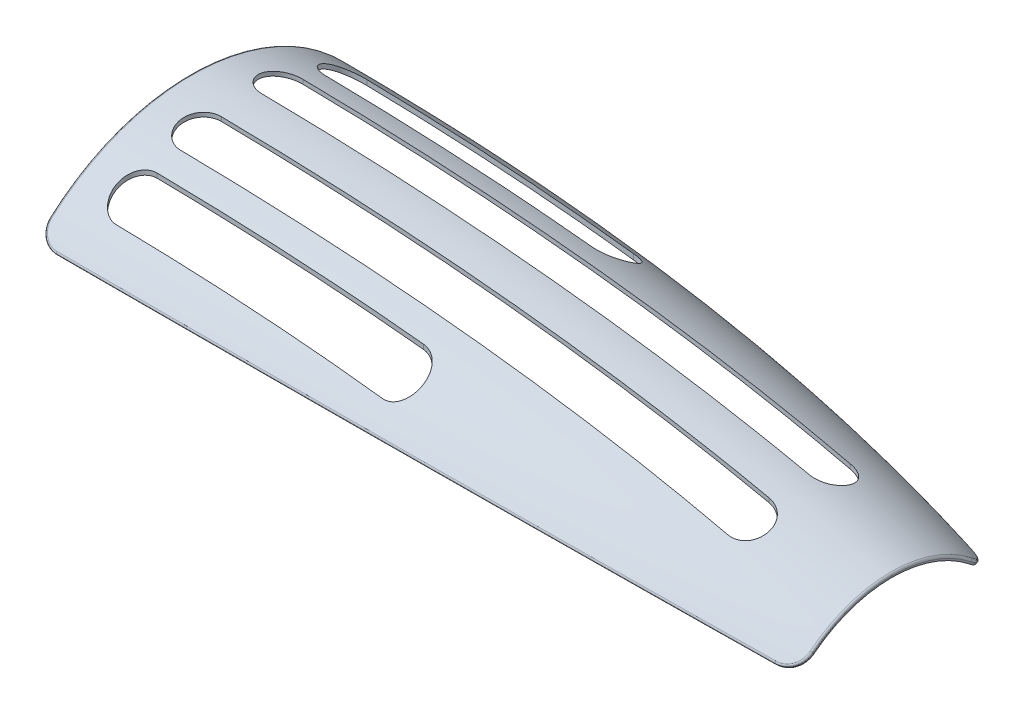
SolidWorks part; units mm, degrees
ref_plane "Plan de face" through (0, 0, 0) normal (0, 0, 1) x (1, 0, 0)
ref_plane "Plan de dessus" through (0, 0, 0) normal (0, 1, 0) x (1, 0, 0)
ref_plane "Plan de droite" through (0, 0, 0) normal (1, 0, 0) x (0, 0, -1)
sketch "Esquisse1" plane through (0, 0, 0) normal (0, 0, 1) x (1, 0, 0)
  line L0 (1937.5186, 118.6008) -> (1937.5186, 33.3089) construction
  line L1 (942.5017, 0) -> (1327.7299, 0) construction
  line L2 (1438.1567, 0) -> (2177.3993, 0) construction
  line L3 (2047, 0) -> (1597, 0) construction
  line L4 (1937.5186, 60.5987) -> (1938.0448, 62.5283)
  line L5 (1597, 102) -> (1597, 100)
  spline S0 degree 3 poles (609.8277, -59.5928) (1435.3906, 164.1167) (2212.55, 34.6313) (2075.8351, -47.2571) (1184.8244, -506.5688) knots -0.725956 -0.725956 -0.725956 -0.725956 0.598241 2.066098 2.066098 2.066098 2.066098 only from (1597, 100) to (2047, 0) construction
  spline S1 degree 3 poles (1597, 100) (1755.2575, 100) (1863.5764, 80.7626) (1937.5186, 60.5987) knots 0 0 0 0 0.523813 0.523813 0.523813 0.523813
  spline S2 degree 1 poles (1597, 102) (1938.0448, 62.5283) knots 0 0 1 1 construction
  spline S3 degree 3 poles (1597, 102) (1599.4631, 102) (1604.407, 101.9906) (1614.1538, 101.9347) (1626.1714, 101.7965) (1640.2993, 101.5244) (1658.7601, 101.0247) (1681.1327, 100.1514) (1706.8786, 98.7325) (1731.5456, 96.9694) (1763.0269, 94.1956) (1799.7952, 90.0019) (1833.2706, 85.0185) (1858.166, 80.6653) (1875.9177, 77.244) (1892.7722, 73.6931) (1906.0891, 70.6485) (1916.3162, 68.1749) (1923.7774, 66.3039) (1929.8189, 64.7355) (1934.5576, 63.4742) (1936.879, 62.8462) (1938.0448, 62.5283) knots 0 0 0 0 0.008185 0.016369 0.032738 0.049107 0.065477 0.098215 0.130953 0.163692 0.19643 0.261907 0.327383 0.360122 0.39286 0.425598 0.458337 0.474706 0.491075 0.507444 0.515629 0.523813 0.523813 0.523813 0.523813
  dimension "D1" = 2
revolve "Révolution1" add sketch "Esquisse1" angle 95 about L1
fillet "Congé1" radius 10 4 edges at (1937.7817, 41.5917, 45.3894) (1937.7817, 41.5917, -45.3894) (1597, 68.2346, -74.465) (1597, 68.2346, 74.465)
fillet "Congé2" radius 1 8 edges at (1934.6039, 44.461, 45.2801) (1938.0448, 62.5283, 0) (1935.8784, 45.1392, -44.1146) (1600.754, 70.5069, -73.7023) (1597, 102, 0) (1599.1806, 71.6393, 72.6055)
sketch "Esquisse2" plane through (0, 0, 0) normal (0, 1, 0) x (1, 0, 0)
  line L0 (1550.6258, 0) -> (1980.5646, 0) construction
  line L1 (1842.4826, 0) -> (1616.8127, 0) construction
  line L2 (1622, 19.7401) -> (1887.6186, 19.7401) construction
  line L3 (1622, 29.7401) -> (1887.6186, 29.7401)
  line L4 (1622, 9.7401) -> (1887.6186, 9.7401)
  line L5 (1622, 50.887) -> (1751.2851, 50.887) construction
  line L6 (1622, 60.887) -> (1751.2851, 60.887)
  line L7 (1622, 40.887) -> (1751.2851, 40.887)
  line L8 (1597, 67.343) -> (1597, -67.343) construction
  arc A0 (1622, 29.7401) -> (1622, 9.7401) centre (1622, 19.7401) ccw
  arc A1 (1887.6186, 9.7401) -> (1887.6186, 29.7401) centre (1887.6186, 19.7401) ccw
  arc A2 (1622, 60.887) -> (1622, 40.887) centre (1622, 50.887) ccw
  arc A3 (1751.2851, 40.887) -> (1751.2851, 60.887) centre (1751.2851, 50.887) ccw
  point P7 (1754.8093, 19.7401)
  point P12 (1686.6425, 50.887)
  dimension "D1" = 10
  dimension "D2" = 10
  dimension "D3" = 25
extrude "Enlèv. mat.-Extru.2" cut sketch "Esquisse2" along normal through all
mirror "Symétrie1" about plane through (0, 0, 0) normal (0, 0, 1) of "Enlèv. mat.-Extru.2"
sketch "Esquisse3" plane through (0, 0, 0) normal (0, 0, 1) x (1, 0, 0)
  line L1 (1558.4783, 142.7147) -> (1958.4404, 142.7147)
  line L2 (1558.4783, 142.7147) -> (1558.4783, 12.206)
  line L3 (1558.4783, 12.206) -> (1958.4404, 12.206)
  line L4 (1958.4404, 142.7147) -> (1958.4404, 12.206)
extrude "Enlèv. mat.-Extru.3" [suppressed] cut sketch "Esquisse3" along normal through all
